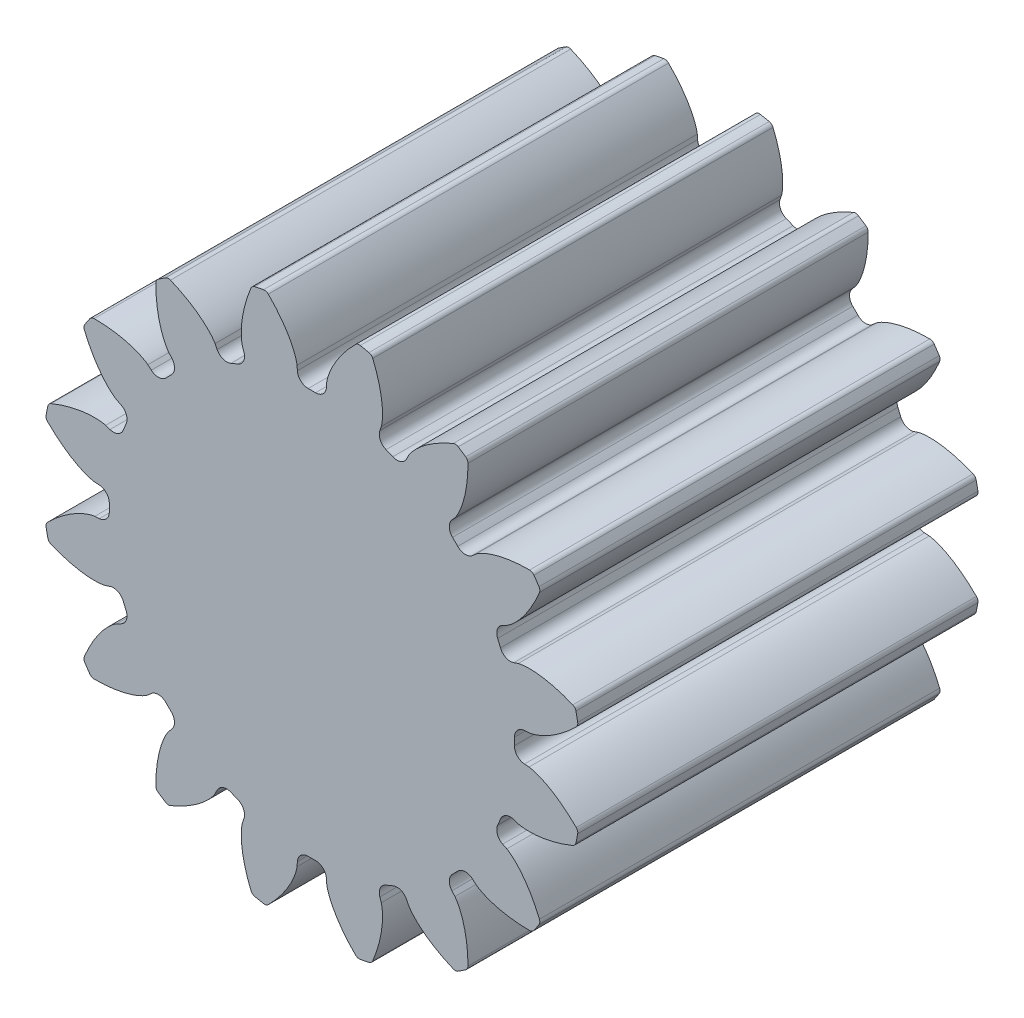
SolidWorks part; units mm, degrees
ref_plane "Front" through (0, 0, 0) normal (0, 0, 1) x (1, 0, 0)
ref_plane "Top" through (0, 0, 0) normal (0, 1, 0) x (1, 0, 0)
ref_plane "Right" through (0, 0, 0) normal (1, 0, 0) x (0, 0, -1)
sketch "Sketch1" plane through (0, 0, 0) normal (0, 0, 1) x (1, 0, 0)
  circle A0 centre (0, 0) radius 8.5725
extrude "Boss-Extrude1" add sketch "Sketch1" along normal blind 12.7
sketch "Sketch3" plane through (0, 0, 0) normal (0, 0, 1) x (1, 0, 0)
  line L0 (0, 0) -> (43.7181, 0) construction
  line L2 (0, 0) -> (-0.4381, 6.4144) construction
  line L3 (0, 0) -> (0.4381, 6.4144) construction
  line L4 (0.4381, 6.4144) -> (0.4706, 6.89) construction
  line L5 (0, 0) -> (0, 61.276) construction
  line L6 (-0.4381, 6.4144) -> (-0.4706, 6.89) construction
  circle A0 centre (0, 0) radius 8.5725 construction
  circle A1 centre (0, 0) radius 7.62 construction
  circle A2 centre (0, 0) radius 6.9061 construction
  arc A3 (0.4381, 6.4144) -> (-0.4381, 6.4144) centre (0, 0) ccw construction
  arc A5 (1.4462, 8.4496) -> (-1.4462, 8.4496) centre (0, 0) ccw
  spline S0 degree 4 poles (-0.4706, 6.89) (-0.4709, 6.8928) (-0.4716, 6.9005) (-0.4736, 6.915) (-0.4776, 6.9386) (-0.4838, 6.9685) (-0.4931, 7.007) (-0.5055, 7.052) (-0.5209, 7.1011) (-0.5394, 7.1542) (-0.5594, 7.2067) (-0.5808, 7.2587) (-0.6035, 7.3102) (-0.6324, 7.372) (-0.6692, 7.4455) (-0.7153, 7.5303) (-0.7711, 7.6252) (-0.8318, 7.7204) (-0.8946, 7.8128) (-0.9615, 7.9047) (-1.0287, 7.9924) (-1.102, 8.0818) (-1.1714, 8.1635) (-1.253, 8.253) (-1.3199, 8.3247) (-1.4122, 8.417) (-1.4678, 8.4708) (-1.5343, 8.533) (-1.5646, 8.5602) (-1.5831, 8.577) knots 0 0 0 0 0 0.005377 0.015084 0.028532 0.04661 0.064855 0.092111 0.119476 0.146842 0.174209 0.201575 0.228941 0.256307 0.307035 0.361767 0.4165 0.471232 0.525964 0.580697 0.635429 0.690161 0.744894 0.799626 0.854358 0.909091 0.954545 1 1 1 1 1 construction
  spline S1 degree 4 poles (-0.4706, 6.89) (-0.4709, 6.8928) (-0.4716, 6.9005) (-0.4736, 6.915) (-0.4776, 6.9386) (-0.4838, 6.9685) (-0.4931, 7.007) (-0.5055, 7.052) (-0.5209, 7.1011) (-0.5394, 7.1542) (-0.5594, 7.2067) (-0.5808, 7.2587) (-0.6035, 7.3102) (-0.6324, 7.372) (-0.6692, 7.4455) (-0.7153, 7.5303) (-0.7711, 7.6252) (-0.8318, 7.7204) (-0.8946, 7.8128) (-0.9615, 7.9047) (-1.0287, 7.9924) (-1.102, 8.0818) (-1.1714, 8.1635) (-1.253, 8.253) (-1.3199, 8.3247) (-1.3922, 8.397) (-1.4278, 8.4319) (-1.4462, 8.4496) knots 0 0 0 0 0 0.005377 0.015084 0.028532 0.04661 0.064855 0.092111 0.119476 0.146842 0.174209 0.201575 0.228941 0.256307 0.307035 0.361767 0.4165 0.471232 0.525964 0.580697 0.635429 0.690161 0.744894 0.799626 0.854358 0.909091 0.909091 0.909091 0.909091 0.909091
  spline S2 degree 4 poles (0.4706, 6.89) (0.4709, 6.8928) (0.4716, 6.9005) (0.4736, 6.915) (0.4776, 6.9386) (0.4838, 6.9685) (0.4931, 7.007) (0.5055, 7.052) (0.5209, 7.1011) (0.5394, 7.1542) (0.5594, 7.2067) (0.5808, 7.2587) (0.6035, 7.3102) (0.6324, 7.372) (0.6692, 7.4455) (0.7153, 7.5303) (0.7711, 7.6252) (0.8318, 7.7204) (0.8946, 7.8128) (0.9615, 7.9047) (1.0287, 7.9924) (1.102, 8.0818) (1.1714, 8.1635) (1.253, 8.253) (1.3199, 8.3247) (1.4122, 8.417) (1.4678, 8.4708) (1.5343, 8.533) (1.5646, 8.5602) (1.5831, 8.577) knots 0 0 0 0 0 0.005377 0.015084 0.028532 0.04661 0.064855 0.092111 0.119476 0.146842 0.174209 0.201575 0.228941 0.256307 0.307035 0.361767 0.4165 0.471232 0.525964 0.580697 0.635429 0.690161 0.744894 0.799626 0.854358 0.909091 0.954545 1 1 1 1 1 construction
  spline S3 degree 4 poles (0.4706, 6.89) (0.4709, 6.8928) (0.4716, 6.9005) (0.4736, 6.915) (0.4776, 6.9386) (0.4838, 6.9685) (0.4931, 7.007) (0.5055, 7.052) (0.5209, 7.1011) (0.5394, 7.1542) (0.5594, 7.2067) (0.5808, 7.2587) (0.6035, 7.3102) (0.6324, 7.372) (0.6692, 7.4455) (0.7153, 7.5303) (0.7711, 7.6252) (0.8318, 7.7204) (0.8946, 7.8128) (0.9615, 7.9047) (1.0287, 7.9924) (1.102, 8.0818) (1.1714, 8.1635) (1.253, 8.253) (1.3199, 8.3247) (1.3922, 8.397) (1.4278, 8.4319) (1.4462, 8.4496) knots 0 0 0 0 0 0.005377 0.015084 0.028532 0.04661 0.064855 0.092111 0.119476 0.146842 0.174209 0.201575 0.228941 0.256307 0.307035 0.361767 0.4165 0.471232 0.525964 0.580697 0.635429 0.690161 0.744894 0.799626 0.854358 0.909091 0.909091 0.909091 0.909091 0.909091
  point P0 (0, 6.4294)
sketch "DCLTBC" plane through (0, 0, 0) normal (0, 0, 1) x (1, 0, 0)
  line L0 (0, 0) -> (41.04, 0) construction
  line L1 (-0.4381, 6.4144) -> (-0.4706, 6.89) construction
  line L2 (0.4381, 6.4144) -> (0.4706, 6.89) construction
  line L3 (-0.4381, 6.4144) -> (-0.4706, 6.89)
  line L4 (0.4381, 6.4144) -> (0.4706, 6.89)
  line L5 (0, 0) -> (0, 104.9356) construction
  circle A0 centre (0, 0) radius 8.5725
  circle A1 centre (0, 0) radius 7.62 construction
  circle A2 centre (0, 0) radius 6.9061 construction
  arc A3 (0.4381, 6.4144) -> (-0.4381, 6.4144) centre (0, 0) ccw construction
  arc A4 (0.4381, 6.4144) -> (-0.4381, 6.4144) centre (0, 0) ccw
  spline S0 degree 4 poles (-997.0581, -75.388) (-12.0164, 5.1207) (-0.596, 6.2387) (-0.4207, 6.6027) (-0.4776, 6.9386) (-0.4838, 6.9685) (-0.4931, 7.007) (-0.5055, 7.052) (-0.5209, 7.1011) (-0.5394, 7.1542) (-0.5594, 7.2067) (-0.5808, 7.2587) (-0.6035, 7.3102) (-0.6324, 7.372) (-0.6692, 7.4455) (-0.7153, 7.5303) (-0.7711, 7.6252) (-0.8318, 7.7204) (-0.8946, 7.8128) (-0.9615, 7.9047) (-1.0287, 7.9924) (-1.102, 8.0818) (-1.1714, 8.1635) (-1.253, 8.253) (-1.6157, 8.6413) (-3.0085, 9.8921) (15.9856, -8.5915) (-721.5241, 702.2907) knots -0.616689 -0.616689 -0.616689 -0.616689 -0.616689 0.005377 0.015084 0.028532 0.04661 0.064855 0.092111 0.119476 0.146842 0.174209 0.201575 0.228941 0.256307 0.307035 0.361767 0.4165 0.471232 0.525964 0.580697 0.635429 0.690161 0.744894 0.799626 0.854358 1.876373 1.876373 1.876373 1.876373 1.876373 only from (-0.4706, 6.89) to (-1.4462, 8.4496) construction
  spline S1 degree 4 poles (997.0581, -75.3879) (12.0164, 5.1207) (0.596, 6.2387) (0.4207, 6.6027) (0.4776, 6.9386) (0.4838, 6.9685) (0.4931, 7.007) (0.5055, 7.052) (0.5209, 7.1011) (0.5394, 7.1542) (0.5594, 7.2067) (0.5808, 7.2587) (0.6035, 7.3102) (0.6324, 7.372) (0.6692, 7.4455) (0.7153, 7.5303) (0.7711, 7.6252) (0.8318, 7.7204) (0.8946, 7.8128) (0.9615, 7.9047) (1.0287, 7.9924) (1.102, 8.0818) (1.1714, 8.1635) (1.253, 8.253) (1.6157, 8.6413) (3.0085, 9.8921) (-15.9856, -8.5915) (721.5241, 702.2907) knots -0.616689 -0.616689 -0.616689 -0.616689 -0.616689 0.005377 0.015084 0.028532 0.04661 0.064855 0.092111 0.119476 0.146842 0.174209 0.201575 0.228941 0.256307 0.307035 0.361767 0.4165 0.471232 0.525964 0.580697 0.635429 0.690161 0.744894 0.799626 0.854358 1.876373 1.876373 1.876373 1.876373 1.876373 only from (0.4706, 6.89) to (1.4462, 8.4496) construction
  spline S2 degree 4 poles (-0.4706, 6.89) (-0.4709, 6.8928) (-0.4716, 6.9005) (-0.4736, 6.915) (-0.4776, 6.9386) (-0.4838, 6.9685) (-0.4931, 7.007) (-0.5055, 7.052) (-0.5209, 7.1011) (-0.5394, 7.1542) (-0.5594, 7.2067) (-0.5808, 7.2587) (-0.6035, 7.3102) (-0.6324, 7.372) (-0.6692, 7.4455) (-0.7153, 7.5303) (-0.7711, 7.6252) (-0.8318, 7.7204) (-0.8946, 7.8128) (-0.9615, 7.9047) (-1.0287, 7.9924) (-1.102, 8.0818) (-1.1714, 8.1635) (-1.253, 8.253) (-1.3199, 8.3247) (-1.3922, 8.397) (-1.4278, 8.4319) (-1.4462, 8.4496) knots 0 0 0 0 0 0.005377 0.015084 0.028532 0.04661 0.064855 0.092111 0.119476 0.146842 0.174209 0.201575 0.228941 0.256307 0.307035 0.361767 0.4165 0.471232 0.525964 0.580697 0.635429 0.690161 0.744894 0.799626 0.854358 0.909091 0.909091 0.909091 0.909091 0.909091
  spline S3 degree 4 poles (0.4706, 6.89) (0.4709, 6.8928) (0.4716, 6.9005) (0.4736, 6.915) (0.4776, 6.9386) (0.4838, 6.9685) (0.4931, 7.007) (0.5055, 7.052) (0.5209, 7.1011) (0.5394, 7.1542) (0.5594, 7.2067) (0.5808, 7.2587) (0.6035, 7.3102) (0.6324, 7.372) (0.6692, 7.4455) (0.7153, 7.5303) (0.7711, 7.6252) (0.8318, 7.7204) (0.8946, 7.8128) (0.9615, 7.9047) (1.0287, 7.9924) (1.102, 8.0818) (1.1714, 8.1635) (1.253, 8.253) (1.3199, 8.3247) (1.3922, 8.397) (1.4278, 8.4319) (1.4462, 8.4496) knots 0 0 0 0 0 0.005377 0.015084 0.028532 0.04661 0.064855 0.092111 0.119476 0.146842 0.174209 0.201575 0.228941 0.256307 0.307035 0.361767 0.4165 0.471232 0.525964 0.580697 0.635429 0.690161 0.744894 0.799626 0.854358 0.909091 0.909091 0.909091 0.909091 0.909091
extrude "Cut-Extrude-DCLTBC" cut sketch "DCLTBC" along normal through all
fillet "Fillet-Tip-DCLTBC" radius 0.1694 2 edges at (1.4462, 8.4496, 6.35) (-1.4462, 8.4496, 6.35)
fillet "Fillet-Root-DCLTBC" radius 0.3388 2 edges at (-0.4381, 6.4144, 6.35) (0.4381, 6.4144, 6.35)
pattern_circular "CirPattern-DCLTBC" count 16 over 360 about axis through (0, 0, 12.7) along (0, 0, 1) of "Cut-Extrude-DCLTBC", "Fillet-Tip-DCLTBC", "Fillet-Root-DCLTBC"
sketch "DCGTBC" [suppressed] plane through (0, 0, 0) normal (0, 0, 1) x (1, 0, 0)
  line L0 (0, 0) -> (41.04, 0) construction
  line L1 (-36.0573, 3.1546) -> (0, 0) construction
  line L2 (0, 0) -> (36.0573, 3.1546) construction
  line L3 (0, 0) -> (-16.5124, 0)
  line L5 (0, 0) -> (0, 104.9356) construction
  circle A0 centre (0, 0) radius 39.624
  circle A1 centre (0, 0) radius 38.1 construction
  circle A2 centre (0, 0) radius 34.5303 construction
  arc A3 (0.0521, 36.195) -> (-0.0521, 36.195) centre (0, 0) ccw construction
  arc A11 (36.0573, 3.1546) -> (-36.0573, 3.1546) centre (0, 0) ccw
  spline S4 degree 4 poles (1999.378, -10.2587) (24.0219, 31.7907) (0.4034, 32.7286) (-0.0173, 33.7057) (0.0582, 34.6738) (0.0676, 34.7628) (0.0826, 34.8777) (0.1039, 35.0128) (0.131, 35.1611) (0.1647, 35.3222) (0.2019, 35.4825) (0.2423, 35.6422) (0.2857, 35.8009) (0.3417, 35.9929) (0.414, 36.2224) (0.5056, 36.4899) (0.618, 36.792) (0.7417, 37.0987) (0.8709, 37.3993) (1.01, 37.7016) (1.1506, 37.9931) (1.3054, 38.2943) (1.4527, 38.5715) (1.6273, 38.8803) (2.3467, 40.1242) (4.9856, 44.0663) (-26.2901, -5.776) (1072.1467, 1729.097) knots -0.598982 -0.598982 -0.598982 -0.598982 -0.598982 0.005377 0.015084 0.028532 0.04661 0.064855 0.092111 0.119476 0.146842 0.174209 0.201575 0.228941 0.256307 0.307035 0.361767 0.4165 0.471232 0.525964 0.580697 0.635429 0.690161 0.744894 0.799626 0.854358 1.785624 1.785624 1.785624 1.785624 1.785624 only from (0.0497, 34.5303) to (2.045, 39.5712) construction
  spline S5 degree 4 poles (-1999.378, -10.2587) (-24.0219, 31.7907) (-0.4034, 32.7286) (0.0173, 33.7057) (-0.0582, 34.6738) (-0.0676, 34.7628) (-0.0826, 34.8777) (-0.1039, 35.0128) (-0.131, 35.1611) (-0.1647, 35.3222) (-0.2019, 35.4825) (-0.2423, 35.6422) (-0.2857, 35.8009) (-0.3417, 35.9929) (-0.414, 36.2224) (-0.5056, 36.4899) (-0.618, 36.792) (-0.7417, 37.0987) (-0.8709, 37.3993) (-1.01, 37.7016) (-1.1506, 37.9931) (-1.3054, 38.2943) (-1.4527, 38.5715) (-1.6273, 38.8803) (-2.3467, 40.1242) (-4.9856, 44.0663) (26.2901, -5.776) (-1072.1467, 1729.097) knots -0.598982 -0.598982 -0.598982 -0.598982 -0.598982 0.005377 0.015084 0.028532 0.04661 0.064855 0.092111 0.119476 0.146842 0.174209 0.201575 0.228941 0.256307 0.307035 0.361767 0.4165 0.471232 0.525964 0.580697 0.635429 0.690161 0.744894 0.799626 0.854358 1.785624 1.785624 1.785624 1.785624 1.785624 only from (-0.0497, 34.5303) to (-2.045, 39.5712) construction
  spline S6 degree 4 poles (0.0497, 34.5303) (0.0499, 34.5384) (0.0505, 34.5611) (0.0528, 34.6039) (0.0582, 34.6738) (0.0676, 34.7628) (0.0826, 34.8777) (0.1039, 35.0128) (0.131, 35.1611) (0.1647, 35.3222) (0.2019, 35.4825) (0.2423, 35.6422) (0.2857, 35.8009) (0.3417, 35.9929) (0.414, 36.2224) (0.5056, 36.4899) (0.618, 36.792) (0.7417, 37.0987) (0.8709, 37.3993) (1.01, 37.7016) (1.1506, 37.9931) (1.3054, 38.2943) (1.4527, 38.5715) (1.6273, 38.8803) (1.7711, 39.1289) (1.9276, 39.384) (2.0049, 39.508) (2.045, 39.5712) knots 0 0 0 0 0 0.005377 0.015084 0.028532 0.04661 0.064855 0.092111 0.119476 0.146842 0.174209 0.201575 0.228941 0.256307 0.307035 0.361767 0.4165 0.471232 0.525964 0.580697 0.635429 0.690161 0.744894 0.799626 0.854358 0.909091 0.909091 0.909091 0.909091 0.909091
  spline S7 degree 4 poles (-0.0497, 34.5303) (-0.0499, 34.5384) (-0.0505, 34.5611) (-0.0528, 34.6039) (-0.0582, 34.6738) (-0.0676, 34.7628) (-0.0826, 34.8777) (-0.1039, 35.0128) (-0.131, 35.1611) (-0.1647, 35.3222) (-0.2019, 35.4825) (-0.2423, 35.6422) (-0.2857, 35.8009) (-0.3417, 35.9929) (-0.414, 36.2224) (-0.5056, 36.4899) (-0.618, 36.792) (-0.7417, 37.0987) (-0.8709, 37.3993) (-1.01, 37.7016) (-1.1506, 37.9931) (-1.3054, 38.2943) (-1.4527, 38.5715) (-1.6273, 38.8803) (-1.7711, 39.1289) (-1.9276, 39.384) (-2.0049, 39.508) (-2.045, 39.5712) knots 0 0 0 0 0 0.005377 0.015084 0.028532 0.04661 0.064855 0.092111 0.119476 0.146842 0.174209 0.201575 0.228941 0.256307 0.307035 0.361767 0.4165 0.471232 0.525964 0.580697 0.635429 0.690161 0.744894 0.799626 0.854358 0.909091 0.909091 0.909091 0.909091 0.909091
  dimension "D1" = 5
  dimension "D2" = 5
extrude "Cut-Extrude-DCGTBC" [suppressed] cut sketch "DCGTBC" along normal through all
fillet "Fillet-Tip-DCGTBC" [suppressed] radius 0.1694
pattern_circular "CirPattern-DCGTBC" [suppressed] count 16 over 360
sketch "Sketch4" plane through (0, 0, 12.7) normal (0, 0, 1) x (1, 0, 0)
  circle A0 centre (0, 0) radius 3.048
  dimension "D1" = 6.096
equation "\"DiametralPitch\"= 80 / 3'Diametral Pitch"
equation "\"NumTeeth\"= 80 / 5'Number of Teeth"
equation "\"PressureAngle\"= 25deg'Pressure Angle"
equation "\"Addendum\"= 1 / \"DiametralPitch\"'Addendum"
equation "\"Dedendum\"= 1.25 / \"DiametralPitch\"'Dedendum"
equation "\"WorkingDepth\"= 2 / \"DiametralPitch\"'Working Depth - here for REF (Not used in building model)"
equation "\"WholeDepth\"= 2.25 / \"DiametralPitch\"'Whole Depth - here for REF (Not used in building model)"
equation "\"Clearance\"= .25 / \"DiametralPitch\"'Clearance"
equation "\"CircularPitch\"= pi / \"DiametralPitch\"'Circular Pitch - here for REF (Not used in building model)"
equation "\"PitchCircle\"= \"NumTeeth\" / \"DiametralPitch\"'Pitch Circle - or - Pitch Diameter"
equation "\"OutsideDiameter\"= ( \"NumTeeth\" + 2 ) / \"DiametralPitch\"'Outside Diameter"
equation "\"Fillet_Root\"= \"Clearance\" * cos ( \"PressureAngle\" ) * tan ( ( 90 + \"PressureAngle\" ) / 2 ) 'Fillet Root"
equation "\"AddendumCircle\"= \"PitchCircle\" + ( 2 * \"Addendum\" )'Addendum Circle - or - Addendum Diameter"
equation "\"DedendumCircle\"= \"PitchCircle\" - ( 2 * \"Dedendum\" )'Dedendum Circle - or - Dedendum Diameter"
equation "\"BaseCircle\"= \"PitchCircle\" * cos ( \"PressureAngle\" )'Base Circle - Base Diameter"
equation "\"PitchAngle\"= 360deg / \"NumTeeth\"'Pitch Angle"
equation "\"Alpha\"= sqr ( \"PitchCircle\" ^ 2 - \"BaseCircle\" ^ 2 ) / \"BaseCircle\" * 180 / PI - \"PressureAngle\"'Alpha - Used for Calculating Beta"
equation "\"Beta\"= ( \"PitchAngle\" / 4 - ( \"Alpha\" - 90 ) )'Beta - Used in definition of the parameters for the parametric equation driven curve"
equation "\"Gamma\"= ( \"PitchAngle\" / 4 - ( \"Alpha\" + 90 ) )'Gamma - Used in definition of the parameters for the parametric equation driven curve"
equation "\"Phi\"= sqr ( ( \"AddendumCircle\" / 2 ) ^ 2 - ( \"BaseCircle\" / 2 ) ^ 2 ) / ( \"BaseCircle\" / 2 )'Phi - Used in definition of the parameters for the parametric equation driven curve"
equation "\"DCGTBC\"= iif ( \"DedendumCircle\" > \"BaseCircle\" , \"unsuppressed\" , \"suppressed\" )'if Dedendum Circle IS GREATER THAN BaseCircle THEN UnsuppressORSuppress FEATURE"
equation "\"DCLTBC\"= iif ( \"DedendumCircle\" - .002 > \"BaseCircle\" , \"suppressed\" , \"unsuppressed\" )'if Dedendum Circle - .002 IS GREATER THAN BaseCircle THEN SuppressORUnsuppress FEATURE"
equation "\"Cut-Extrude-DCGTBC\"= iif ( \"DedendumCircle\" > \"BaseCircle\" , \"unsuppressed\" , \"suppressed\" )'if Dedendum Circle IS GREATER THAN BaseCircle THEN UnsuppressORSuppress FEATURE"
equation "\"Cut-Extrude-DCLTBC\"= iif ( \"DedendumCircle\" - .002 > \"BaseCircle\" , \"suppressed\" , \"unsuppressed\" )'if Dedendum Circle - .002 IS GREATER THAN BaseCircle THEN SuppressORUnsuppress FEATURE"
equation "\"CirPattern-DCGTBC\"= iif ( \"DedendumCircle\" > \"BaseCircle\" , \"unsuppressed\" , \"suppressed\" )'if Dedendum Circle IS GREATER THAN BaseCircle THEN UnsuppressORSuppress FEATURE"
equation "\"CirPattern-DCLTBC\"= iif ( \"DedendumCircle\" - .002 > \"BaseCircle\" , \"suppressed\" , \"unsuppressed\" )'if Dedendum Circle - .002 IS GREATER THAN BaseCircle THEN SuppressORUnsuppress FEATURE"
equation "\"Fillet-Tip-DCGTBC\"= iif ( \"DedendumCircle\" > \"BaseCircle\" , \"unsuppressed\" , \"suppressed\" )'if Dedendum Circle IS GREATER THAN BaseCircle THEN UnsuppressORSuppress FEATURE"
equation "\"Fillet-Tip-DCLTBC\"= iif ( \"DedendumCircle\" - .002 > \"BaseCircle\" , \"suppressed\" , \"unsuppressed\" )'if Dedendum Circle - .002 IS GREATER THAN BaseCircle THEN SuppressORUnsuppress FEATURE"
equation "\"Fillet-Root-DCLTBC\"= iif ( \"DedendumCircle\" - .002 > \"BaseCircle\" , \"suppressed\" , \"unsuppressed\" )'if Dedendum Circle - .002 IS GREATER THAN BaseCircle THEN SuppressORUnsuppress FEATURE"
equation "\"D1@CirPattern-DCGTBC\"= \"NumTeeth\"'Number of Teeth"
equation "\"D1@CirPattern-DCLTBC\"= \"NumTeeth\"'Number of Teeth"
equation "\"D1@Fillet-Tip-DCGTBC\"= \"Fillet_Root\" / 2 'Tip Rad For Large No of Teeth"
equation "\"D1@Fillet-Tip-DCLTBC\"=\"Fillet_Root\" / 2'Tip Rad For Small No of Teeth"
equation "\"D1@Fillet-Root-DCLTBC\"= \"Fillet_Root\"'Fillet Root"
